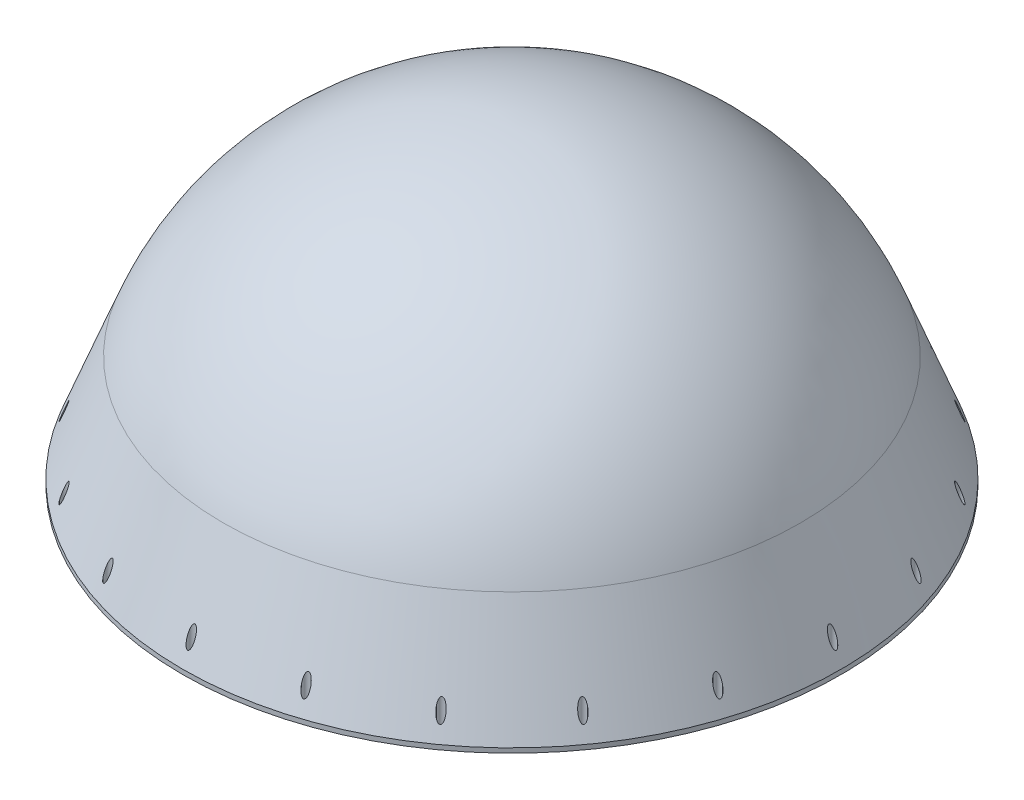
SolidWorks part; units mm, degrees
ref_plane "Front" through (0, 0, 0) normal (0, 0, 1) x (1, 0, 0)
ref_plane "Top" through (0, 0, 0) normal (0, 1, 0) x (1, 0, 0)
ref_plane "Right" through (0, 0, 0) normal (1, 0, 0) x (0, 0, -1)
sketch "Sketch1" plane through (0, 0, 0) normal (0, 0, 1) x (1, 0, 0)
  line L0 (0, 0) -> (0, 180.6647) construction
  line L1 (161.544, 0) -> (180.975, 0)
  line L2 (180.975, 0) -> (180.975, 2.54)
  line L3 (180.975, 2.54) -> (158.5779, 60.8795)
  line L4 (161.544, 34.0815) -> (161.544, 0)
  line L5 (0, 169.8625) -> (0, 165.1)
  arc A0 (158.5779, 60.8795) -> (0, 169.8625) centre (0, 0) ccw
  arc A1 (161.544, 34.0815) -> (0, 165.1) centre (0, 0) ccw
  dimension "D1" = 339.725
  dimension "D4" = 330.2
  dimension "D2" = 180.975
  dimension "D3" = 2.54
  dimension "D5" = 161.544
  dimension "D6" = 169.8625
revolve "Revolve1" add sketch "Sketch1" angle 360 about L5
ref_plane "Plane1" through (0, 2.54, 0) normal (0, 1, 0) x (-1, 0, 0)
hole_wizard "#10-32 Tapped Hole1" positions "Sketch6" profile "Sketch5" tap size "#10-32" standard "Ansi Inch"
sketch "Sketch6" plane through (0, 0, 0) normal (0, -1, 0) x (1, 0, 0)
  point P0 (-176.0728, 0)
  dimension "D1" = 176.0728
sketch "Sketch5" plane through (-176.0728, 0, 0) normal (1, 0, 0) x (0, 0, -1)
  line L0 (0, 0) -> (0, 38.5513)
  line L1 (0, 38.5513) -> (2.0193, 37.338)
  line L2 (2.0193, 37.338) -> (2.0193, 0)
  line L5 (2.0193, 0) -> (0, 0)
  line L10 (0, 38.5513) -> (-2.0193, 37.338) construction
  line L11 (0, -6.35) -> (0, 107.95) construction
  dimension "Tap Drill Dia." = 4.0386
  dimension "Tap Drill Depth" = 37.338
  dimension "Drill Angle" = 118
pattern_circular "CirPattern1" count 20 over 360 about axis through (0, 0, 0) along (0, 1, 0) of "#10-32 Tapped Hole1"
ref_plane "Plane2" through (0, 0, 0) normal (-1, 0, 0) x (0, 0, -1)
sketch "Sketch7" plane through (0, 0, 0) normal (-1, 0, 0) x (0, 0, -1)
  line L0 (164.8968, -2.2358) -> (164.7012, 0)
  line L1 (164.7012, 0) -> (169.7152, 0)
  line L2 (169.7152, 0) -> (169.5196, -2.2358)
  line L3 (169.0768, -2.6416) -> (165.3396, -2.6416)
  line L4 (0, 50) -> (0, -50) construction
  arc A0 (169.5196, -2.2358) -> (169.0768, -2.6416) centre (169.0768, -2.1971) cw
  arc A1 (165.3396, -2.6416) -> (164.8968, -2.2358) centre (165.3396, -2.1971) cw
revolve "Groove for AS 568-279, O-Ring1" cut sketch "Sketch7"
